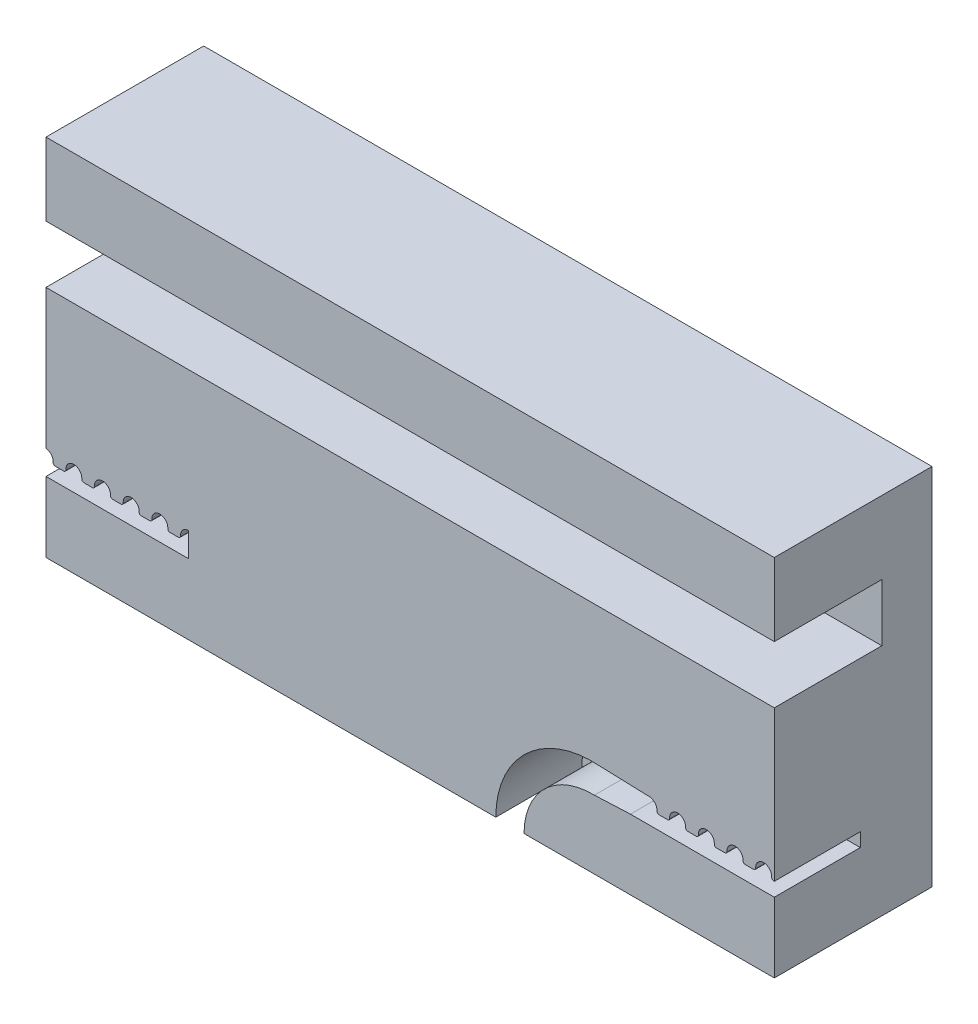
SolidWorks part; units mm, degrees
ref_plane "Front Plane" through (0, 0, 0) normal (0, 0, 1) x (1, 0, 0)
ref_plane "Top Plane" through (0, 0, 0) normal (0, 1, 0) x (1, 0, 0)
ref_plane "Right Plane" through (0, 0, 0) normal (1, 0, 0) x (0, 0, -1)
sketch "Sketch1" plane through (0, 0, 0) normal (0, 0, 1) x (1, 0, 0)
  line L1 (-25.4, -12.7) -> (25.4, -12.7)
  line L2 (-25.4, -12.7) -> (-25.4, 12.7)
  line L3 (-25.4, 12.7) -> (25.4, 12.7)
  line L4 (25.4, -12.7) -> (25.4, 12.7)
  line L5 (-25.4, -12.7) -> (25.4, 12.7) construction
  line L6 (-25.4, 12.7) -> (25.4, -12.7) construction
  point P0 (0, 0)
  dimension "D1" = 50.8
  dimension "D2" = 25.4
extrude "Boss-Extrude1" add sketch "Sketch1" along normal blind 12.46
sketch "Sketch3" plane through (0, 0, 12.46) normal (0, 0, 1) x (1, 0, 0)
  line L18 (-23.4652, -6.1) -> (-23.4591, -6.1)
  line L19 (-21.4652, -6.1) -> (-21.4591, -6.1)
  line L20 (-19.4654, -6.1) -> (-19.4591, -6.1)
  line L21 (-17.4652, -6.1) -> (-17.4591, -6.1)
  line L27 (18.6591, -6.1) -> (18.6652, -6.1)
  line L28 (20.6591, -6.1) -> (20.6652, -6.1)
  line L29 (22.6591, -6.1) -> (22.6652, -6.1)
  line L30 (24.6591, -6.1) -> (24.6652, -6.1)
  line L32 (16.6798, -6.1004) -> (13.256, -5.9831)
  line L33 (25.365, -6.86) -> (25.365, -7.82)
  line L34 (-25.4393, -7.8004) -> (-15.4652, -7.8004)
  line L35 (15.365, -7.82) -> (25.365, -7.82)
  line L38 (15.365, -7.82) -> (12.8505, -7.931)
  line L47 (5.9752, -12.7) -> (7.943, -12.7)
  line L48 (19.365, -6.86) -> (19.9562, -6.86)
  line L49 (21.365, -6.86) -> (21.9562, -6.86)
  line L50 (23.365, -6.86) -> (23.9562, -6.86)
  line L51 (-25.4393, -6.1004) -> (-25.4393, -7.8004)
  line L52 (-15.4652, -6.1004) -> (-15.4652, -7.8004)
  line L390 (17.215, -6.6226) -> (17.2131, -6.6226)
  line L391 (17.215, -6.71) -> (17.215, -6.6226)
  line L392 (17.9562, -6.86) -> (17.365, -6.86)
  line L398 (19.215, -6.6226) -> (19.2131, -6.6226)
  line L399 (19.215, -6.71) -> (19.215, -6.6226)
  line L406 (21.215, -6.6226) -> (21.2131, -6.6226)
  line L407 (21.215, -6.71) -> (21.215, -6.6226)
  line L414 (23.215, -6.6226) -> (23.2131, -6.6226)
  line L415 (23.215, -6.71) -> (23.215, -6.6226)
  line L422 (25.215, -6.6226) -> (25.2131, -6.6226)
  line L423 (25.215, -6.71) -> (25.215, -6.6226)
  line L1628 (8.8889, -27.3539) -> (8.8889, 27.3539) construction
  line L1737 (-24.9041, -6.6549) -> (-24.9041, -6.6559)
  line L1738 (-24.7562, -6.86) -> (-24.165, -6.86)
  line L1739 (-24.015, -6.71) -> (-24.015, -6.6226)
  line L1740 (-24.015, -6.6226) -> (-24.0131, -6.6226)
  line L1745 (-22.9041, -6.6549) -> (-22.9041, -6.6559)
  line L1746 (-22.7562, -6.86) -> (-22.165, -6.86)
  line L1747 (-22.015, -6.71) -> (-22.015, -6.6226)
  line L1748 (-22.015, -6.6226) -> (-22.0131, -6.6226)
  line L1753 (-20.9041, -6.6549) -> (-20.9041, -6.6559)
  line L1754 (-20.7562, -6.86) -> (-20.165, -6.86)
  line L1755 (-20.015, -6.71) -> (-20.015, -6.6226)
  line L1756 (-20.015, -6.6226) -> (-20.0131, -6.6226)
  line L1761 (-18.9041, -6.655) -> (-18.9041, -6.656)
  line L1762 (-18.7563, -6.86) -> (-18.1651, -6.8601)
  line L1763 (-18.0151, -6.7101) -> (-18.0151, -6.6226)
  line L1764 (-18.0151, -6.6226) -> (-18.0132, -6.6226)
  line L1770 (-16.7562, -6.86) -> (-16.165, -6.86)
  line L1771 (-16.015, -6.71) -> (-16.015, -6.6226)
  line L1772 (-16.015, -6.6226) -> (-16.0131, -6.6226)
  line L1773 (-15.4652, -6.1) -> (-15.4652, -6.1004)
  arc A3 (13.256, -5.9831) -> (5.9752, -12.7) centre (12.714, -12.7) ccw
  arc A5 (12.8505, -7.931) -> (7.943, -12.7) centre (12.714, -12.7) ccw
  arc A235 (17.2131, -6.6226) -> (16.6798, -6.1004) centre (16.6591, -6.655) ccw
  arc A236 (17.215, -6.71) -> (17.365, -6.86) centre (17.365, -6.71) ccw
  arc A237 (17.9562, -6.86) -> (18.1057, -6.6983) centre (17.9562, -6.71) ccw
  arc A238 (18.1041, -6.6549) -> (18.1057, -6.6983) centre (18.6591, -6.655) ccw
  arc A239 (18.6591, -6.1) -> (18.1041, -6.6549) centre (18.6591, -6.655) ccw
  arc A240 (19.2131, -6.6226) -> (18.6652, -6.1) centre (18.6591, -6.655) ccw
  arc A241 (19.215, -6.71) -> (19.365, -6.86) centre (19.365, -6.71) ccw
  arc A242 (19.9562, -6.86) -> (20.1058, -6.6983) centre (19.9562, -6.71) ccw
  arc A243 (20.1041, -6.6549) -> (20.1058, -6.6983) centre (20.6591, -6.655) ccw
  arc A244 (20.6591, -6.1) -> (20.1041, -6.6549) centre (20.6591, -6.655) ccw
  arc A245 (21.2131, -6.6226) -> (20.6652, -6.1) centre (20.6591, -6.655) ccw
  arc A246 (21.215, -6.71) -> (21.365, -6.86) centre (21.365, -6.71) ccw
  arc A247 (21.9562, -6.86) -> (22.1057, -6.6983) centre (21.9562, -6.71) ccw
  arc A248 (22.1041, -6.655) -> (22.1057, -6.6983) centre (22.6591, -6.655) ccw
  arc A249 (22.6591, -6.1) -> (22.1041, -6.655) centre (22.6591, -6.655) ccw
  arc A250 (23.2131, -6.6226) -> (22.6652, -6.1) centre (22.6591, -6.655) ccw
  arc A251 (23.215, -6.71) -> (23.365, -6.86) centre (23.365, -6.71) ccw
  arc A252 (23.9562, -6.86) -> (24.1058, -6.6983) centre (23.9562, -6.71) ccw
  arc A253 (24.1041, -6.655) -> (24.1058, -6.6983) centre (24.6591, -6.655) ccw
  arc A254 (24.6591, -6.1) -> (24.1041, -6.655) centre (24.6591, -6.655) ccw
  arc A255 (25.2131, -6.6226) -> (24.6652, -6.1) centre (24.6591, -6.655) ccw
  arc A256 (25.215, -6.71) -> (25.365, -6.86) centre (25.365, -6.71) ccw
  arc A1065 (-25.4393, -6.1004) -> (-24.9041, -6.6549) centre (-25.4591, -6.655) cw
  arc A1066 (-24.9041, -6.6559) -> (-24.9057, -6.6983) centre (-25.4591, -6.655) cw
  arc A1067 (-24.7562, -6.86) -> (-24.9057, -6.6983) centre (-24.7562, -6.71) cw
  arc A1068 (-24.015, -6.71) -> (-24.165, -6.86) centre (-24.165, -6.71) cw
  arc A1069 (-24.0131, -6.6226) -> (-23.4652, -6.1) centre (-23.4591, -6.655) cw
  arc A1070 (-23.4591, -6.1) -> (-22.9041, -6.6549) centre (-23.4591, -6.655) cw
  arc A1071 (-22.9041, -6.6559) -> (-22.9058, -6.6983) centre (-23.4591, -6.655) cw
  arc A1072 (-22.7562, -6.86) -> (-22.9058, -6.6983) centre (-22.7562, -6.71) cw
  arc A1073 (-22.015, -6.71) -> (-22.165, -6.86) centre (-22.165, -6.71) cw
  arc A1074 (-22.0131, -6.6226) -> (-21.4652, -6.1) centre (-21.4591, -6.655) cw
  arc A1075 (-21.4591, -6.1) -> (-20.9041, -6.6549) centre (-21.4591, -6.655) cw
  arc A1076 (-20.9041, -6.6559) -> (-20.9057, -6.6983) centre (-21.4591, -6.655) cw
  arc A1077 (-20.7562, -6.86) -> (-20.9057, -6.6983) centre (-20.7562, -6.71) cw
  arc A1078 (-20.015, -6.71) -> (-20.165, -6.86) centre (-20.165, -6.71) cw
  arc A1079 (-20.0131, -6.6226) -> (-19.4654, -6.1) centre (-19.4591, -6.655) cw
  arc A1080 (-19.4591, -6.1) -> (-18.9041, -6.655) centre (-19.4591, -6.655) cw
  arc A1081 (-18.9041, -6.656) -> (-18.9058, -6.6983) centre (-19.4591, -6.655) cw
  arc A1082 (-18.7563, -6.86) -> (-18.9058, -6.6983) centre (-18.7563, -6.71) cw
  arc A1083 (-18.0151, -6.7101) -> (-18.1651, -6.8601) centre (-18.1651, -6.7101) cw
  arc A1084 (-18.0132, -6.6226) -> (-17.4652, -6.1) centre (-17.4591, -6.655) cw
  arc A1085 (-17.4591, -6.1) -> (-16.9041, -6.6549) centre (-17.4591, -6.655) cw
  arc A1086 (-16.9041, -6.6549) -> (-16.9058, -6.6983) centre (-17.4591, -6.655) cw
  arc A1087 (-16.7562, -6.86) -> (-16.9058, -6.6983) centre (-16.7562, -6.71) cw
  arc A1088 (-16.015, -6.71) -> (-16.165, -6.86) centre (-16.165, -6.71) cw
  arc A1089 (-16.0131, -6.6226) -> (-15.4652, -6.1) centre (-15.4591, -6.655) cw
  point P24 (8.8889, 0)
  dimension "D2" = 6.7387
  dimension "D4" = 4.7709
  dimension "D1" = 1.7
  dimension "D5" = 3.4238
  dimension "D6" = 3.9659
sketch "Sketch4" plane through (0, 0, 12.46) normal (0, 0, 1) x (1, 0, 0)
  line L1 (-19.05, -12.7) -> (19.05, -12.7)
  line L2 (-19.05, -12.7) -> (-19.05, 12.7)
  line L3 (-19.05, 12.7) -> (19.05, 12.7)
  line L4 (19.05, -12.7) -> (19.05, 12.7)
  line L5 (-19.05, -12.7) -> (19.05, 12.7) construction
  line L6 (-19.05, 12.7) -> (19.05, -12.7) construction
  point P0 (0, 0)
  dimension "D1" = 38.1
extrude "Boss-Extrude2" add sketch "Sketch4" along normal blind 44.45
sketch "Sketch5" plane through (0, 12.7, 0) normal (0, 1, 0) x (1, 0, 0)
  line L1 (-13.335, -44.845) -> (13.335, -44.845)
  line L2 (-13.335, -44.845) -> (-13.335, -18.175)
  line L3 (-13.335, -18.175) -> (13.335, -18.175)
  line L4 (13.335, -44.845) -> (13.335, -18.175)
  line L5 (-13.335, -44.845) -> (13.335, -18.175) construction
  line L6 (-13.335, -18.175) -> (13.335, -44.845) construction
  line L8 (-19.05, -56.91) -> (-19.05, -12.46) construction
  line L9 (19.05, -56.91) -> (-19.05, -56.91) construction
  point P0 (0, -31.51)
  point P9 (0, -31.51)
  dimension "D1" = 19.05
  dimension "D2" = 26.67
  dimension "D3" = 26.67
  dimension "D4" = 25.4
extrude "Cut-Extrude1" cut sketch "Sketch5" against normal blind 19.05
sketch "Sketch7" plane through (0, -6.35, 0) normal (0, 1, 0) x (1, 0, 0)
  line L0 (-13.335, -44.845) -> (13.335, -44.845) construction
  circle A0 centre (0, -31.51) radius 3.429
  point P0 (0, -31.51)
  dimension "D2" = 6.858
  dimension "D1" = 13.335
extrude "Cut-Extrude2" cut sketch "Sketch7" against normal through all
sketch "Sketch8" plane through (-25.4, 0, 0) normal (-1, 0, 0) x (0, 0, 1)
  line L0 (0, 12.7) -> (0, -12.7) construction
  line L2 (-5.207, 1.3879) -> (-5.207, -1.3879)
  line L5 (0, 2.54) -> (0, -2.54)
  line L7 (-4.3402, 3.2989) -> (-2.667, 4.764)
  line L8 (-2.667, 4.764) -> (-2.667, 2.54)
  line L10 (-2.667, -4.764) -> (-2.667, -2.54)
  line L11 (-4.3402, -3.2989) -> (-2.667, -4.764)
  line L12 (-2.667, 2.54) -> (0, 2.54)
  line L13 (-2.667, -2.54) -> (0, -2.54)
  arc A0 (-4.3402, 3.2989) -> (-5.207, 1.3879) centre (-2.667, 1.3879) ccw
  arc A1 (-5.207, -1.3879) -> (-4.3402, -3.2989) centre (-2.667, -1.3879) ccw
  point P0 (-3.937, -1.0959)
  dimension "D1" = 2.54
  dimension "D2" = 2.54
  dimension "D7" = 2.224
  dimension "D3" = 5.08
  dimension "D4" = 9.5279
  dimension "D5" = 2.54
  dimension "D6" = 2.224
  dimension "D8" = 2.667
  dimension "D9" = 2.54
sketch "Sketch10" plane through (25.4, 0, 0) normal (1, 0, 0) x (0, 0, -1)
  line L0 (-12.46, -12.7) -> (-12.46, 12.7) construction
  line L2 (-12.46, 7.62) -> (-12.46, 3.62)
  line L7 (-12.46, 7.62) -> (-4.96, 7.62)
  line L8 (-4.96, 7.62) -> (-4.96, 3.62)
  line L9 (-4.96, 3.62) -> (-12.46, 3.62)
  dimension "D1" = 7.5
  dimension "D2" = 4
extrude "Cut-Extrude3" cut sketch "Sketch10" against normal through all
extrude "Cut-Extrude4" cut sketch "Sketch3" against normal blind 6
sketch "Sketch11" plane through (0, 0, 0) normal (0, 0, -1) x (-1, 0, 0)
  line L1 (-25.4, 12.7) -> (25.4, 12.7)
  line L2 (-25.4, 12.7) -> (-25.4, -12.7)
  line L3 (-25.4, -12.7) -> (25.4, -12.7)
  line L4 (25.4, 12.7) -> (25.4, -12.7)
extrude "Boss-Extrude3" add sketch "Sketch11" along normal blind 2.54
sketch "Sketch12" plane through (0, 0, 56.91) normal (0, 0, 1) x (1, 0, 0)
  circle A0 centre (0, 0) radius 2.54
  dimension "D1" = 5.08
extrude "Cut-Extrude5" cut sketch "Sketch12" against normal blind 7.62
sketch "Sketch13" plane through (-19.05, 0, 0) normal (-1, 0, 0) x (0, 0, 1)
  line L1 (12.46, 12.7) -> (56.91, 12.7)
  line L2 (12.46, 12.7) -> (12.46, -12.7)
  line L3 (12.46, -12.7) -> (56.91, -12.7)
  line L4 (56.91, 12.7) -> (56.91, -12.7)
extrude "Cut-Extrude6" cut sketch "Sketch13" against normal through all
sketch "Sketch15" plane through (25.365, 0, 0) normal (-1, 0, 0) x (0, 0, 1)
  line L0 (6.46, -6.86) -> (6.46, -7.82)
  line L1 (6.46, -7.82) -> (6.46, -6.86) construction
  line L2 (6.46, -7.82) -> (12.46, -7.82)
  line L3 (12.46, -7.82) -> (12.46, -6.86)
  line L4 (12.46, -6.86) -> (6.46, -6.86)
extrude "Cut-Extrude8" cut sketch "Sketch15" against normal blind 10
sketch "Sketch14" plane through (0, 0, -2.54) normal (0, 0, -1) x (-1, 0, 0)
  line L1 (-25.4, 12.7) -> (25.4, 12.7)
  line L2 (-25.4, 12.7) -> (-25.4, -12.7)
  line L3 (-25.4, -12.7) -> (25.4, -12.7)
  line L4 (25.4, 12.7) -> (25.4, -12.7)
extrude "Cut-Extrude7" cut sketch "Sketch14" against normal blind 4
